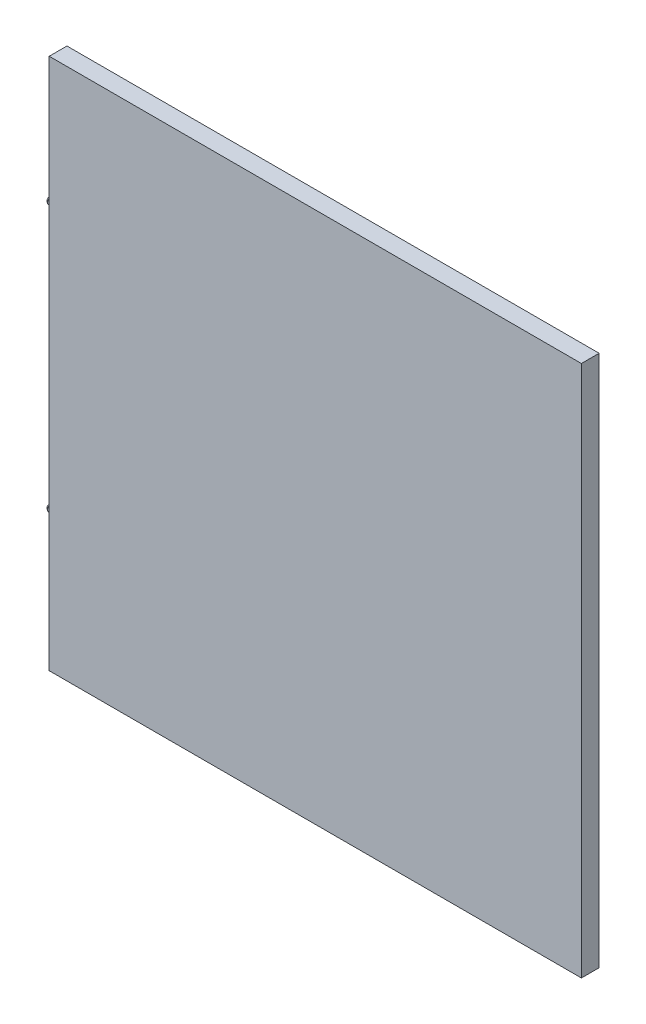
SolidWorks part; units mm, degrees
ref_plane "Front Plane" through (0, 0, 0) normal (0, 0, 1) x (1, 0, 0)
ref_plane "Top Plane" through (0, 0, 0) normal (0, 1, 0) x (1, 0, 0)
ref_plane "Right Plane" through (0, 0, 0) normal (1, 0, 0) x (0, 0, -1)
sketch "Sketch1" plane through (0, 0, 0) normal (0, 0, 1) x (1, 0, 0)
  line L1 (-150, -150) -> (150, -150)
  line L2 (-150, -150) -> (-150, 150)
  line L3 (-150, 150) -> (150, 150)
  line L4 (150, -150) -> (150, 150)
  line L5 (-150, -150) -> (150, 150) construction
  line L6 (-150, 150) -> (150, -150) construction
  point P0 (0, 0)
  dimension "D1" = 300
  dimension "D2" = 300
extrude "Boss-Extrude1" add sketch "Sketch1" along normal blind 10
sketch "Sketch2" plane through (0, 0, 0) normal (0, 0, -1) x (-1, 0, 0)
  line L0 (-150, 0) -> (0, 0) construction
  line L1 (-150, -150) -> (-150, 150) construction
  circle A0 centre (-144, 75) radius 2
  circle A1 centre (-144, -75) radius 2
  dimension "D2" = 4
  dimension "D3" = 150
  dimension "D1" = 6
extrude "Cut-Extrude1" cut sketch "Sketch2" against normal blind 5
sketch "Sketch3" plane through (-150, 0, 0) normal (-1, 0, 0) x (0, 0, 1)
  line L0 (0, 0) -> (-69.5131, 0) construction
  line L1 (0, 150) -> (0, -150) construction
  line L2 (5, 150) -> (5, -150) construction
  line L3 (10, 150) -> (0, 150) construction
  line L4 (10, -150) -> (0, -150) construction
  circle A0 centre (5, 75) radius 2
  circle A1 centre (5, -75) radius 2
  dimension "D1" = 4
  dimension "D2" = 150
extrude "Boss-Extrude2" add sketch "Sketch3" along normal blind 5 draft 1
chamfer "Chamfer1" distance 1 angle 30 2 edges at (-155, -75, 3.0873) (-155, 75, 6.9127)
